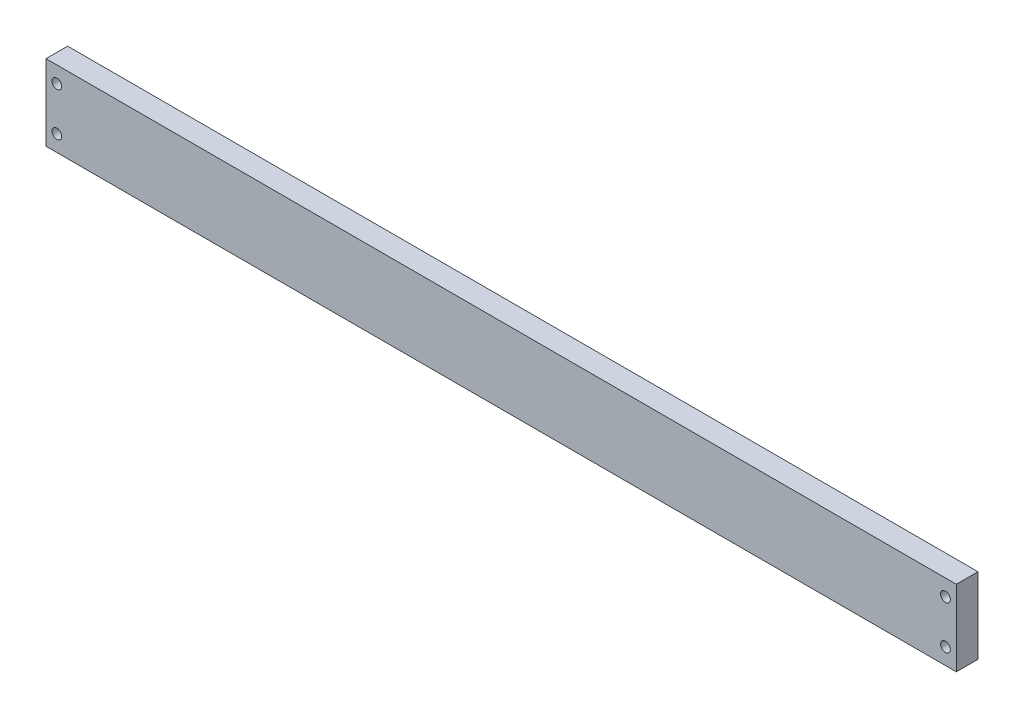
SolidWorks part; units mm, degrees
ref_plane "Спереди" through (0, 0, 0) normal (0, 0, 1) x (1, 0, 0)
ref_plane "Сверху" through (0, 0, 0) normal (0, 1, 0) x (1, 0, 0)
ref_plane "Справа" through (0, 0, 0) normal (1, 0, 0) x (0, 0, -1)
sketch "Эскиз1" plane through (0, 0, 0) normal (0, 0, 1) x (1, 0, 0)
  line L1 (210, 17.5) -> (-210, 17.5)
  line L2 (210, 17.5) -> (210, -17.5)
  line L3 (210, -17.5) -> (-210, -17.5)
  line L4 (-210, 17.5) -> (-210, -17.5)
  line L5 (210, 17.5) -> (-210, -17.5) construction
  line L6 (210, -17.5) -> (-210, 17.5) construction
  point P0 (0, 0)
  dimension "D1" = 420
  dimension "D2" = 35
other "Выровнять группу5"
other "Выровнять группу6"
other "Выровнять группу7"
other "Выровнять группу8"
other "Выровнять группу9"
other "Выровнять группу10"
other "Выровнять группу11"
other "Выровнять группу12"
other "Выровнять группу13"
other "Выровнять группу14"
extrude "Бобышка-Вытянуть1" add sketch "Эскиз1" along normal blind 10
sketch "Эскиз4" plane through (0, 0, 0) normal (0, 0, -1) x (-1, 0, 0)
  line L0 (-210, -17.5) -> (-210, 17.5) construction
  line L1 (210, 17.5) -> (210, -17.5) construction
  line L2 (-210, 17.5) -> (210, 17.5) construction
  circle A0 centre (-205, 10) radius 2.25
  circle A1 centre (-205, -10) radius 2.25
  circle A2 centre (205, -10) radius 2.25
  circle A3 centre (205, 10) radius 2.25
  dimension "D4" = 4.5
  dimension "D1" = 20
  dimension "D2" = 5
  dimension "D3" = 5
  dimension "D5" = 7.5
extrude "Вырез-Вытянуть1" cut sketch "Эскиз4" against normal blind 10
hole_wizard "Отверстие обработанное метчиком M41" positions "Эскиз9" profile "Эскиз10" tap size "M4" standard "ISO"
sketch "Эскиз9" plane through (0, -17.5, 0) normal (0, -1, 0) x (-1, 0, 0)
  line L0 (210, -10) -> (210, 0) construction
  line L1 (210, -10) -> (-210, -10) construction
  point P0 (190, -5)
  point P5 (210, -5)
  dimension "D1" = 20
  dimension "D2" = 5
sketch "Эскиз10" plane through (-190, -17.5, 5) normal (1, 0, 0) x (0, 0, -1)
  line L0 (0, 0) -> (0, 12.9914)
  line L1 (0, 12.9914) -> (1.65, 12)
  line L2 (1.65, 12) -> (1.65, 0)
  line L5 (1.65, 0) -> (0, 0)
  line L10 (0, 12.9914) -> (-1.65, 12) construction
  line L11 (0, -6.35) -> (0, 107.95) construction
  dimension "Диаметр сверла" = 3.3
  dimension "Глубина сверла" = 12
  dimension "Угол заточки сверла" = 118
pattern_linear "Линейный массив1" [suppressed] count 6 spacing 76
